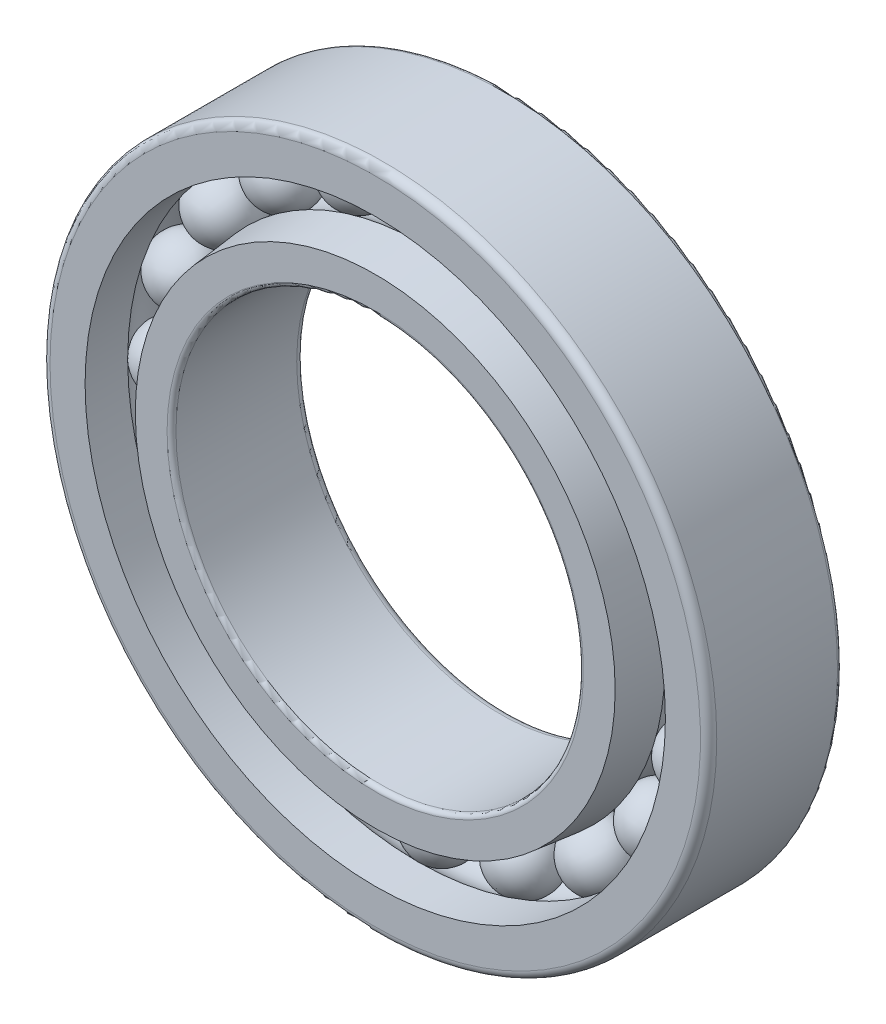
SolidWorks part; units mm, degrees
ref_plane "Front Plane" through (0, 0, 0) normal (0, 0, 1) x (1, 0, 0)
ref_plane "Top Plane" through (0, 0, 0) normal (0, 1, 0) x (1, 0, 0)
ref_plane "Right Plane" through (0, 0, 0) normal (1, 0, 0) x (0, 0, -1)
sketch "BaseSke" plane through (0, 0, 0) normal (1, 0, 0) x (0, 0, -1)
  line L0 (-47.2296, 0) -> (24.6132, 0) construction
  line L1 (-47.2296, 36.25) -> (24.6132, 36.25) construction
  line L2 (0, 129.5214) -> (0, -86.3012) construction
  line L3 (0, 40.625) -> (0, 31.875)
  line L4 (-9, 45) -> (9, 45) construction
  line L5 (-9, 27.5) -> (9, 27.5) construction
  arc A0 (0, 40.625) -> (0, 31.875) centre (0, 36.25) ccw
  dimension "Ball_diameter" = 8.75
  dimension "D1" = 36.25
  dimension "Bearing_Thickness" = 18
  dimension "Bearing_Outside_Diameter" = 90
  dimension "Bearing_Inside_Diameter" = 55
revolve "Ball" add sketch "BaseSke" angle 360 about L3
sketch "OuterRaceSke" plane through (0, 0, 0) normal (1, 0, 0) x (0, 0, -1)
  line L0 (0, 0) -> (0, 87.5396) construction
  line L1 (-9, 45) -> (9, 45)
  line L2 (-9, 45) -> (-9, 39.1667)
  line L3 (-9, 39.1667) -> (-3.2475, 39.1667)
  line L4 (9, 45) -> (9, 40.1126)
  line L5 (-50.3916, 0) -> (55.2197, 0) construction
  line L6 (-47.2296, 36.25) -> (24.6132, 36.25) construction
  line L8 (9, 40.1126) -> (2.9407, 39.4757)
  line L9 (0, 39.1667) -> (-5.0325, 57.9482) construction
  line L10 (0, 39.1667) -> (2.9407, 39.4757) construction
  arc A0 (2.9407, 39.4757) -> (-3.2475, 39.1667) centre (0, 36.25) ccw
  dimension "D4" = 8.73
  dimension "D2" = 78.3333
  dimension "D3" = 6
  dimension "Angle" = 15
revolve "OuterRace" add sketch "OuterRaceSke" angle 360 about L5
sketch "InnerRaceSke" plane through (0, 0, 0) normal (1, 0, 0) x (0, 0, -1)
  line L0 (-70.8626, 0) -> (113.5527, 0) construction
  line L1 (0, 58.441) -> (0, -70.8113) construction
  line L2 (-9, 27.5) -> (9, 27.5)
  line L3 (-9, 27.5) -> (-9, 33.3333)
  line L4 (-9, 33.3333) -> (-3.2475, 33.3333)
  line L5 (9, 27.5) -> (9, 33.3333)
  line L6 (0, 129.5214) -> (0, -86.3012) construction
  line L7 (3.2475, 33.3333) -> (9, 33.3333)
  arc A0 (-3.2475, 33.3333) -> (3.2475, 33.3333) centre (0, 36.25) ccw
  arc A1 (0, 40.625) -> (0, 31.875) centre (0, 36.25) ccw construction
  dimension "D2" = 8.73
  dimension "D1" = 66.6667
revolve "InnerRace" add sketch "InnerRaceSke" angle 360 about L0
fillet "Fillet1" radius 1.1 2 edges at (27.5, 0, -9) (45, 0, 9)
fillet "Fillet2" radius 0.6 2 edges at (45, 0, -9) (27.5, 0, 9)
sketch "CutInnerRaceSke" plane through (0, 0, 0) normal (1, 0, 0) x (0, 0, -1)
  line L0 (-3.2475, 33.3333) -> (-9, 33.3333)
  line L1 (-9, 33.3333) -> (-9, 32.3874)
  line L2 (-9, 32.3874) -> (-2.9407, 33.0243)
  line L3 (-2.9407, 33.0243) -> (0, 33.3333) construction
  line L4 (0, 58.441) -> (0, -70.8113) construction
  line L5 (-28.3066, 0) -> (35.2466, 0) construction
  arc A0 (-3.2475, 33.3333) -> (-2.9407, 33.0243) centre (0, 36.25) ccw
  arc A1 (-3.2475, 33.3333) -> (3.2475, 33.3333) centre (0, 36.25) ccw construction
  dimension "D1" = 6
revolve "CutInnerRace" cut sketch "CutInnerRaceSke" angle 360 about L5
pattern_circular "CirPatternBall" count 20 over 360 about axis through (0, 0, 0) along (0, 0, 1) of "Ball"
sketch "SimplifiedSke" plane through (0, 0, 0) normal (1, 0, 0) x (0, 0, -1)
  line L0 (37.5911, 0) -> (-37.5911, 0) construction
  circle A0 centre (0, 36.25) radius 4.375
  arc A1 (0, 40.625) -> (0, 31.875) centre (0, 36.25) ccw construction
revolve "Simplified" [suppressed] add sketch "SimplifiedSke" angle 360 about L0
equation "\"D1@BaseSke\" =  (\"Bearing_Outside_Diameter@BaseSke\"  +  \"Bearing_Inside_Diameter@BaseSke\"  )  / 4"
equation "\"Ball_diameter@BaseSke\" =  ( \"Bearing_Outside_Diameter@BaseSke\" - \"Bearing_Inside_Diameter@BaseSke\" ) / 4 "
equation "\"D2@OuterRaceSke\" = \"Bearing_Outside_Diameter@BaseSke\" -  ( \"Bearing_Outside_Diameter@BaseSke\" - \"Bearing_Inside_Diameter@BaseSke\" )  / 3"
equation "\"D4@OuterRaceSke\" = (  \"Bearing_Outside_Diameter@BaseSke\" - \"Bearing_Inside_Diameter@BaseSke\" ) / 4 -0.02"
equation "\"D3@OuterRaceSke\" = \"Angle@OuterRaceSke\"/2.5"
equation "\"D1@InnerRaceSke\" = \"Bearing_Inside_Diameter@BaseSke\" +  ( \"Bearing_Outside_Diameter@BaseSke\" - \"Bearing_Inside_Diameter@BaseSke\" )  / 3"
equation "\"D2@InnerRaceSke\" = \"D4@OuterRaceSke\""
equation "\"D1@CirPatternBall\" = int( \"D1@BaseSke\"* pi  * 2 / \"Ball_diameter@BaseSke\"/1.2 ) -1"
equation "\"D1@CutInnerRaceSke\" = \"D3@OuterRaceSke\""
